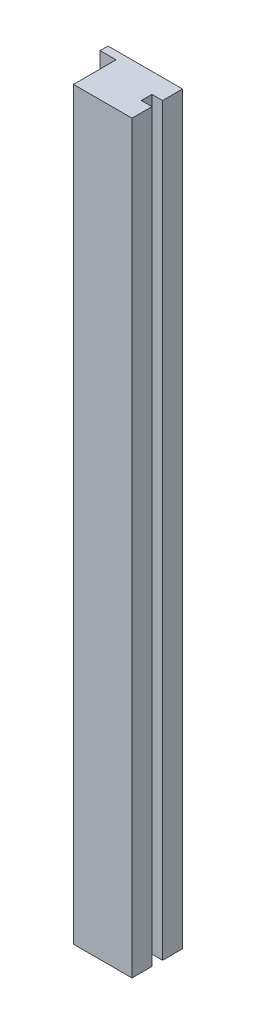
SolidWorks part; units mm, degrees
ref_plane "Plan1" through (0, 0, 0) normal (0, 0, 1) x (1, 0, 0)
ref_plane "Plan2" through (0, 0, 0) normal (0, 1, 0) x (1, 0, 0)
ref_plane "Plan3" through (0, 0, 0) normal (1, 0, 0) x (0, 0, -1)
sketch "Esquisse1" plane through (0, 0, 0) normal (0, 1, 0) x (1, 0, 0)
  line L0 (10.9964, 9.5) -> (10.9964, 5.75)
  line L1 (0, 0) -> (10.9964, 0)
  line L2 (0, 0) -> (0, 8)
  line L3 (0.1894, 9.5) -> (10.9964, 9.5)
  line L4 (0, 4.75) -> (-1.5744, 4.75) construction
  line L5 (10.9964, 5.75) -> (8.9964, 5.75)
  line L6 (8.9964, 5.75) -> (8.9964, 3.75)
  line L7 (10.9964, 3.75) -> (8.9964, 3.75)
  line L8 (0.1894, 9.5) -> (-3, 9.5)
  line L9 (-3, 9.5) -> (-3, 8)
  line L10 (-3, 8) -> (0, 8)
  line L11 (10.9964, 3.75) -> (10.9964, 0)
  point P14 (8.9964, 4.75)
  dimension "D1" = 9.5
  dimension "D2" = 3
  dimension "D3" = 1.5
  dimension "D4" = 1
  dimension "D5" = 2
extrude "Base-Extrusion" add sketch "Esquisse1" along normal blind 140
scale "Echelle1"
